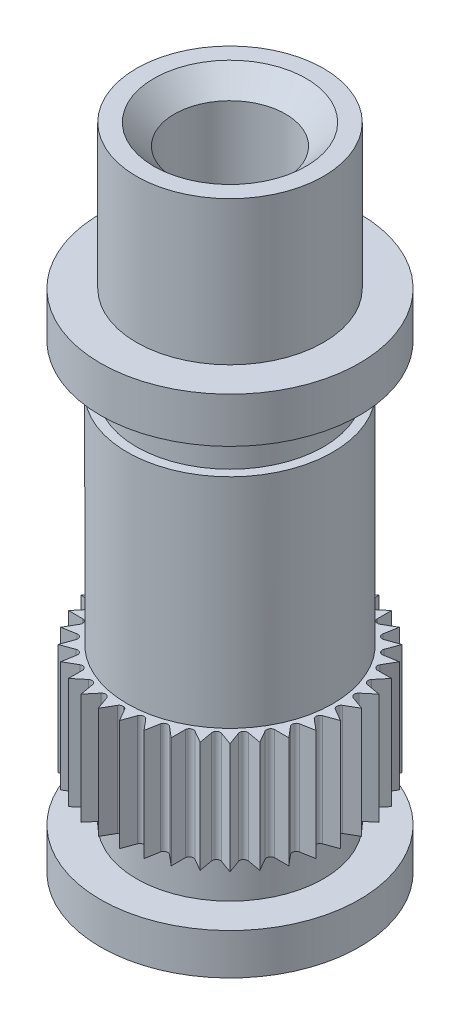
SolidWorks part; units mm, degrees
ref_plane "Front Plane" through (0, 0, 0) normal (0, 0, 1) x (1, 0, 0)
ref_plane "Top Plane" through (0, 0, 0) normal (0, 1, 0) x (1, 0, 0)
ref_plane "Right Plane" through (0, 0, 0) normal (1, 0, 0) x (0, 0, -1)
ref_plane "Plane1" through (0, 2.1, 0) normal (0, -1, 0) x (1, 0, 0)
sketch "Sketch1" plane through (0, 2.1, 0) normal (0, -1, 0) x (1, 0, 0)
  line L0 (0.0866, -2.65) -> (0.2578, -2.9465)
  line L1 (0.2578, -2.9465) -> (0.3749, -2.6248)
  line L2 (0.5455, -2.5947) -> (0.7655, -2.857)
  line L3 (0.7655, -2.857) -> (0.825, -2.5198)
  line L4 (0.9877, -2.4606) -> (1.25, -2.6806)
  line L5 (1.25, -2.6806) -> (1.25, -2.3383)
  line L6 (1.4, -2.2517) -> (1.6965, -2.4228)
  line L7 (1.6965, -2.4228) -> (1.637, -2.0857)
  line L8 (1.7697, -1.9744) -> (2.0914, -2.0914)
  line L9 (2.0914, -2.0914) -> (1.9744, -1.7697)
  line L10 (2.0857, -1.637) -> (2.4228, -1.6965)
  line L11 (2.4228, -1.6965) -> (2.2517, -1.4)
  line L12 (2.3383, -1.25) -> (2.6806, -1.25)
  line L13 (2.6806, -1.25) -> (2.4606, -0.9877)
  line L14 (2.5198, -0.825) -> (2.857, -0.7655)
  line L15 (2.857, -0.7655) -> (2.5947, -0.5455)
  line L16 (2.6248, -0.3749) -> (2.9465, -0.2578)
  line L17 (2.9465, -0.2578) -> (2.65, -0.0866)
  line L18 (2.65, 0.0866) -> (2.9465, 0.2578)
  line L19 (2.9465, 0.2578) -> (2.6248, 0.3749)
  line L20 (2.5947, 0.5455) -> (2.857, 0.7655)
  line L21 (2.857, 0.7655) -> (2.5198, 0.825)
  line L22 (2.4606, 0.9877) -> (2.6806, 1.25)
  line L23 (2.6806, 1.25) -> (2.3383, 1.25)
  line L24 (2.2517, 1.4) -> (2.4228, 1.6965)
  line L25 (2.4228, 1.6965) -> (2.0857, 1.637)
  line L26 (1.9744, 1.7697) -> (2.0914, 2.0914)
  line L27 (2.0914, 2.0914) -> (1.7697, 1.9744)
  line L28 (1.637, 2.0857) -> (1.6965, 2.4228)
  line L29 (1.6965, 2.4228) -> (1.4, 2.2517)
  line L30 (1.25, 2.3383) -> (1.25, 2.6806)
  line L31 (1.25, 2.6806) -> (0.9877, 2.4606)
  line L32 (0.825, 2.5198) -> (0.7655, 2.857)
  line L33 (0.7655, 2.857) -> (0.5455, 2.5947)
  line L34 (0.3749, 2.6248) -> (0.2578, 2.9465)
  line L35 (0.2578, 2.9465) -> (0.0866, 2.65)
  line L36 (-0.0866, 2.65) -> (-0.2578, 2.9465)
  line L37 (-0.2578, 2.9465) -> (-0.3749, 2.6248)
  line L38 (-0.5455, 2.5947) -> (-0.7655, 2.857)
  line L39 (-0.7655, 2.857) -> (-0.825, 2.5198)
  line L40 (-0.9877, 2.4606) -> (-1.25, 2.6806)
  line L41 (-1.25, 2.6806) -> (-1.25, 2.3383)
  line L42 (-1.4, 2.2517) -> (-1.6965, 2.4228)
  line L43 (-1.6965, 2.4228) -> (-1.637, 2.0857)
  line L44 (-1.7697, 1.9744) -> (-2.0914, 2.0914)
  line L45 (-2.0914, 2.0914) -> (-1.9744, 1.7697)
  line L46 (-2.0857, 1.637) -> (-2.4228, 1.6965)
  line L47 (-2.4228, 1.6965) -> (-2.2517, 1.4)
  line L48 (-2.3383, 1.25) -> (-2.6806, 1.25)
  line L49 (-2.6806, 1.25) -> (-2.4606, 0.9877)
  line L50 (-2.5198, 0.825) -> (-2.857, 0.7655)
  line L51 (-2.857, 0.7655) -> (-2.5947, 0.5455)
  line L52 (-2.6248, 0.3749) -> (-2.9465, 0.2578)
  line L53 (-2.9465, 0.2578) -> (-2.65, 0.0866)
  line L54 (-2.65, -0.0866) -> (-2.9465, -0.2578)
  line L55 (-2.9465, -0.2578) -> (-2.6248, -0.3749)
  line L56 (-2.5947, -0.5455) -> (-2.857, -0.7655)
  line L57 (-2.857, -0.7655) -> (-2.5198, -0.825)
  line L58 (-2.4606, -0.9877) -> (-2.6806, -1.25)
  line L59 (-2.6806, -1.25) -> (-2.3383, -1.25)
  line L60 (-2.2517, -1.4) -> (-2.4228, -1.6965)
  line L61 (-2.4228, -1.6965) -> (-2.0857, -1.637)
  line L62 (-1.9744, -1.7697) -> (-2.0914, -2.0914)
  line L63 (-2.0914, -2.0914) -> (-1.7697, -1.9744)
  line L64 (-1.637, -2.0857) -> (-1.6965, -2.4228)
  line L65 (-1.6965, -2.4228) -> (-1.4, -2.2517)
  line L66 (-1.25, -2.3383) -> (-1.25, -2.6806)
  line L67 (-1.25, -2.6806) -> (-0.9877, -2.4606)
  line L68 (-0.825, -2.5198) -> (-0.7655, -2.857)
  line L69 (-0.7655, -2.857) -> (-0.5455, -2.5947)
  line L70 (-0.3749, -2.6248) -> (-0.2578, -2.9465)
  line L71 (-0.2578, -2.9465) -> (-0.0866, -2.65)
  arc A0 (-0.0866, -2.65) -> (0.0866, -2.65) centre (0, -2.7) cw
  arc A1 (0.3749, -2.6248) -> (0.5455, -2.5947) centre (0.4689, -2.659) cw
  arc A2 (0.825, -2.5198) -> (0.9877, -2.4606) centre (0.9235, -2.5372) cw
  arc A3 (1.25, -2.3383) -> (1.4, -2.2517) centre (1.35, -2.3383) cw
  arc A4 (1.637, -2.0857) -> (1.7697, -1.9744) centre (1.7355, -2.0683) cw
  arc A5 (1.9744, -1.7697) -> (2.0857, -1.637) centre (2.0683, -1.7355) cw
  arc A6 (2.2517, -1.4) -> (2.3383, -1.25) centre (2.3383, -1.35) cw
  arc A7 (2.4606, -0.9877) -> (2.5198, -0.825) centre (2.5372, -0.9235) cw
  arc A8 (2.5947, -0.5455) -> (2.6248, -0.3749) centre (2.659, -0.4689) cw
  arc A9 (2.65, -0.0866) -> (2.65, 0.0866) centre (2.7, 0) cw
  arc A10 (2.6248, 0.3749) -> (2.5947, 0.5455) centre (2.659, 0.4689) cw
  arc A11 (2.5198, 0.825) -> (2.4606, 0.9877) centre (2.5372, 0.9235) cw
  arc A12 (2.3383, 1.25) -> (2.2517, 1.4) centre (2.3383, 1.35) cw
  arc A13 (2.0857, 1.637) -> (1.9744, 1.7697) centre (2.0683, 1.7355) cw
  arc A14 (1.7697, 1.9744) -> (1.637, 2.0857) centre (1.7355, 2.0683) cw
  arc A15 (1.4, 2.2517) -> (1.25, 2.3383) centre (1.35, 2.3383) cw
  arc A16 (0.9877, 2.4606) -> (0.825, 2.5198) centre (0.9235, 2.5372) cw
  arc A17 (0.5455, 2.5947) -> (0.3749, 2.6248) centre (0.4689, 2.659) cw
  arc A18 (0.0866, 2.65) -> (-0.0866, 2.65) centre (0, 2.7) cw
  arc A19 (-0.3749, 2.6248) -> (-0.5455, 2.5947) centre (-0.4689, 2.659) cw
  arc A20 (-0.825, 2.5198) -> (-0.9877, 2.4606) centre (-0.9235, 2.5372) cw
  arc A21 (-1.25, 2.3383) -> (-1.4, 2.2517) centre (-1.35, 2.3383) cw
  arc A22 (-1.637, 2.0857) -> (-1.7697, 1.9744) centre (-1.7355, 2.0683) cw
  arc A23 (-1.9744, 1.7697) -> (-2.0857, 1.637) centre (-2.0683, 1.7355) cw
  arc A24 (-2.2517, 1.4) -> (-2.3383, 1.25) centre (-2.3383, 1.35) cw
  arc A25 (-2.4606, 0.9877) -> (-2.5198, 0.825) centre (-2.5372, 0.9235) cw
  arc A26 (-2.5947, 0.5455) -> (-2.6248, 0.3749) centre (-2.659, 0.4689) cw
  arc A27 (-2.65, 0.0866) -> (-2.65, -0.0866) centre (-2.7, 0) cw
  arc A28 (-2.6248, -0.3749) -> (-2.5947, -0.5455) centre (-2.659, -0.4689) cw
  arc A29 (-2.5198, -0.825) -> (-2.4606, -0.9877) centre (-2.5372, -0.9235) cw
  arc A30 (-2.3383, -1.25) -> (-2.2517, -1.4) centre (-2.3383, -1.35) cw
  arc A31 (-2.0857, -1.637) -> (-1.9744, -1.7697) centre (-2.0683, -1.7355) cw
  arc A32 (-1.7697, -1.9744) -> (-1.637, -2.0857) centre (-1.7355, -2.0683) cw
  arc A33 (-1.4, -2.2517) -> (-1.25, -2.3383) centre (-1.35, -2.3383) cw
  arc A34 (-0.9877, -2.4606) -> (-0.825, -2.5198) centre (-0.9235, -2.5372) cw
  arc A35 (-0.5455, -2.5947) -> (-0.3749, -2.6248) centre (-0.4689, -2.659) cw
extrude "Boss-Extrude1" add sketch "Sketch1" against normal blind 2.7
sketch "Sketch2" plane through (0, 0, 0) normal (0, 0, 1) x (1, 0, 0)
  line L0 (2.275, 15.8) -> (0, 15.8)
  line L1 (0, 15.8) -> (0, 4.8)
  line L2 (0, 4.8) -> (2.5, 4.8)
  line L3 (2.5, 4.8) -> (2.5, 10.1)
  line L4 (2.5, 10.1) -> (2.275, 10.1)
  line L5 (2.275, 10.1) -> (2.275, 11.2)
  line L6 (2.275, 11.2) -> (3.15, 11.2)
  line L7 (3.15, 11.2) -> (3.15, 12.3)
  line L8 (3.15, 12.3) -> (2.275, 12.3)
  line L9 (2.275, 12.3) -> (2.275, 15.8)
  line L10 (0, 15.8) -> (0, 4.8) construction
revolve "Revolve1" add sketch "Sketch2" angle 360 about L10
ref_plane "Plane2" through (0, 0, 0) normal (0, 0, -1) x (-1, 0, 0)
sketch "Sketch3" plane through (0, 0, 0) normal (0, 0, -1) x (-1, 0, 0)
  line L0 (-3.15, 0) -> (0, 0)
  line L1 (0, 0) -> (0, 2.1)
  line L2 (0, 2.1) -> (-2.275, 2.1)
  line L3 (-2.275, 2.1) -> (-2.275, 1)
  line L4 (-2.275, 1) -> (-3.15, 1)
  line L5 (-3.15, 1) -> (-3.15, 0)
  line L6 (0, 0) -> (0, 2.1) construction
revolve "Revolve2" add sketch "Sketch3" angle 360 about L6
hole_wizard "#36 (0.1065) Diameter Hole1" positions "Sketch5" profile "Sketch4" hole size "#36" standard "ANSI Inch"
sketch "Sketch5" plane through (0, 15.8, 0) normal (0, 1, 0) x (1, 0, 0)
  point P0 (0, 0)
sketch "Sketch4" plane through (0, 15.8, 0) normal (1, 0, 0) x (0, 0, 1)
  line L0 (0, 0) -> (0, 10.3377)
  line L1 (0, 10.3377) -> (1.3525, 9.525)
  line L2 (1.3525, 9.525) -> (1.3525, 0)
  line L5 (1.3525, 0) -> (0, 0)
  line L10 (0, 10.3377) -> (-1.3525, 9.525) construction
  line L11 (0, -6.35) -> (0, 107.95) construction
  dimension "Hole Dia." = 2.7051
  dimension "Hole Depth" = 9.525
  dimension "Drill Angle" = 118
chamfer "Chamfer1" distance 0.5001 angle 45 1 edges at (0, 15.8, 1.3525)
